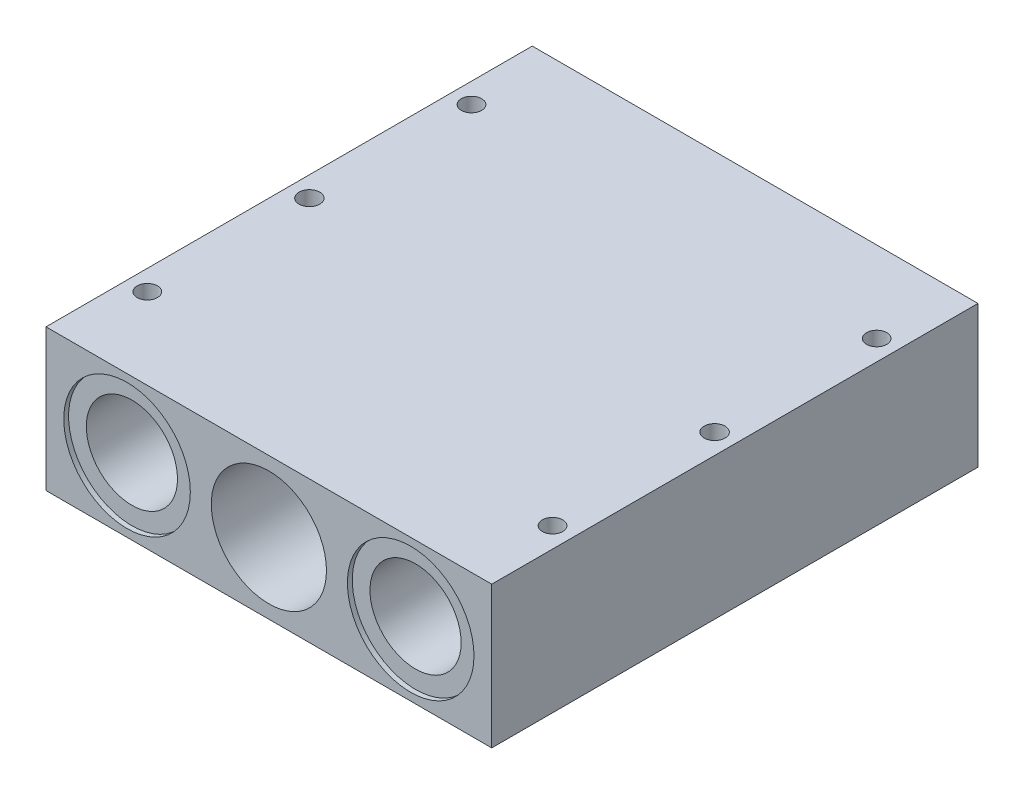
SolidWorks part; units mm, degrees
ref_plane "Front/Back" through (0, 0, 0) normal (0, 0, 1) x (1, 0, 0)
ref_plane "Top/Bottom" through (0, 0, 0) normal (0, 1, 0) x (1, 0, 0)
ref_plane "Right/Left" through (0, 0, 0) normal (1, 0, 0) x (0, 0, -1)
sketch "Sketch1" plane through (0, 0, 0) normal (0, 1, 0) x (1, 0, 0)
  line L0 (0, 0) -> (69.85, 0) construction
  line L1 (-69.85, 76.2) -> (69.85, 76.2)
  line L2 (-69.85, 76.2) -> (-69.85, -76.2)
  line L3 (-69.85, -76.2) -> (69.85, -76.2)
  line L4 (69.85, 76.2) -> (69.85, -76.2)
  line L5 (0, 0) -> (0, 76.2) construction
  dimension "D1" = 139.7
  dimension "D2" = 152.4
extrude "Extrude1" add sketch "Sketch1" along normal mid plane 44.45
sketch "Sketch2" plane through (0, 0, 76.2) normal (0, 0, 1) x (1, 0, 0)
  line L0 (0, 0) -> (0, 25.6254) construction
  line L1 (0, 0) -> (62.4063, 0) construction
  circle A0 centre (44.45, 0) radius 14.2875
  circle A1 centre (-44.45, 0) radius 14.2875
  dimension "D1" = 28.575
  dimension "D2" = 88.9
extrude "Cut-Extrude1" cut sketch "Sketch2" against normal through all
sketch "Sketch3" plane through (0, 0, 76.2) normal (0, 0, 1) x (1, 0, 0)
  circle A0 centre (44.45, 0) radius 19.8374
  circle A1 centre (-44.45, 0) radius 19.8374
  dimension "D1" = 39.6748
extrude "Cut-Extrude2" cut sketch "Sketch3" against normal blind 1.524
sketch "Sketch4" plane through (0, 0, -76.2) normal (0, 0, -1) x (-1, 0, 0)
  circle A0 centre (44.45, 0) radius 19.8374
  circle A1 centre (-44.45, 0) radius 19.8374
  dimension "D1" = 39.6748
extrude "Cut-Extrude3" cut sketch "Sketch4" against normal blind 1.524
sketch "Sketch5" plane through (0, 0, 76.2) normal (0, 0, 1) x (1, 0, 0)
  circle A0 centre (0, 0) radius 18.0467
  dimension "D1" = 36.0934
extrude "Cut-Extrude4" cut sketch "Sketch5" against normal through all
hole_wizard "5/16-18 (Mounting Holes)" positions "Sketch9" profile "Sketch8" tap size "5/16-18" standard "Ansi Inch"
sketch "Sketch9" plane through (0, 22.225, 0) normal (0, 1, 0) x (-1, 0, 0)
  line L0 (69.85, 76.2) -> (-69.85, 76.2) construction
  line L1 (0, 0) -> (0, 38.2418) construction
  line L2 (0, -76.2) -> (0, 76.2) construction
  line L3 (0, 0) -> (26.7344, 0) construction
  point P0 (63.5, 0)
  point P9 (-63.5, 0)
  dimension "D1" = 76.2
  dimension "D2" = 127
sketch "Sketch8" plane through (-63.5, 22.225, 0) normal (1, 0, 0) x (0, 0, 1)
  line L0 (0, 0) -> (0, 44.45)
  line L1 (0, 44.45) -> (3.2639, 44.45)
  line L2 (3.2639, 44.45) -> (3.2639, 0)
  line L5 (3.2639, 0) -> (0, 0)
  line L11 (0, -6.35) -> (0, 107.95) construction
  dimension "Thru Tap Drill Dia." = 6.5278
  dimension "Thru Tap Drill Depth" = 44.45
hole_wizard "(1/4 Dowel Holes - Slip Fit)" positions "Sketch11" profile "Sketch10" legacy
sketch "Sketch11" plane through (0, 22.225, 0) normal (0, 1, 0) x (-1, 0, 0)
  line L0 (0, 0) -> (75.7862, 0) construction
  line L1 (0, 0) -> (0, 67.5334) construction
  line L2 (0, -76.2) -> (0, 76.2) construction
  line L3 (69.85, 76.2) -> (-69.85, 76.2) construction
  point P0 (63.5, 50.8)
  point P1 (63.5, -50.8)
  point P2 (-63.5, -50.8)
  point P3 (-63.5, 50.8)
  dimension "D1" = 127
  dimension "D2" = 101.6
  dimension "D3" = 25.4
sketch "Sketch10" plane through (-63.5, 22.225, 50.8) normal (1, 0, 0) x (0, 0, 1)
  line L0 (0, 0) -> (0, 6.35)
  line L1 (0, 6.35) -> (3.1877, 6.35)
  line L2 (3.1877, 6.35) -> (3.1877, 0)
  line L3 (3.1877, 0) -> (0, 0)
  line L4 (0, 110) -> (0, -10) construction
  dimension "Diameter" = 6.3754
  dimension "Depth" = 6.35
